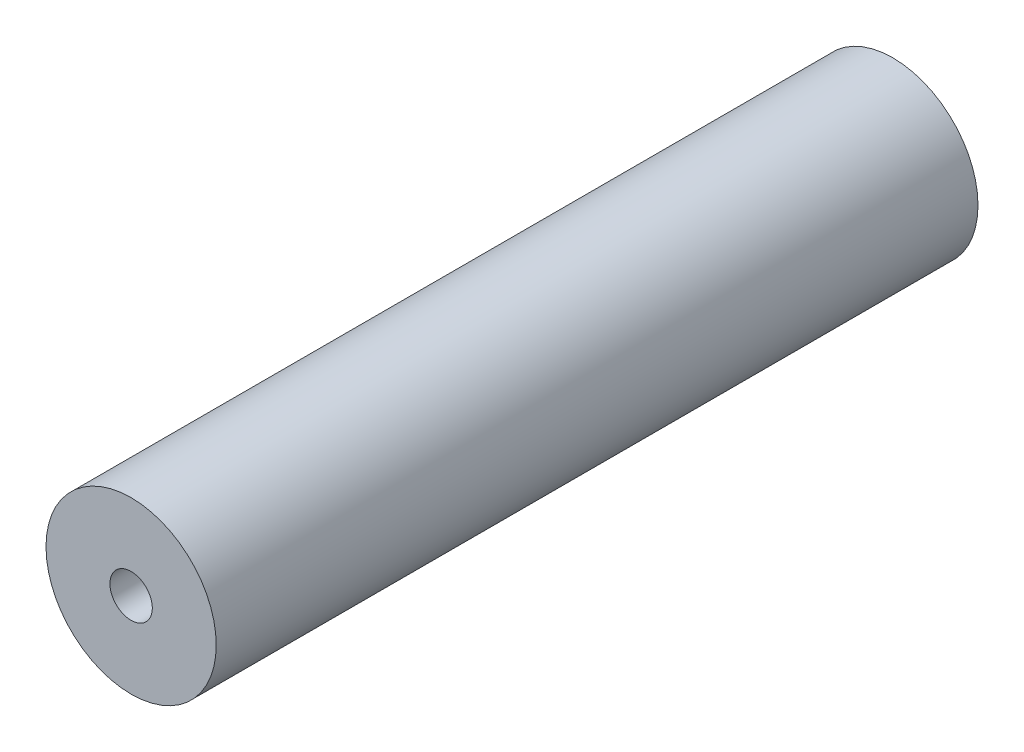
SolidWorks part; units mm, degrees
ref_plane "Front Plane" through (0, 0, 0) normal (0, 0, 1) x (1, 0, 0)
ref_plane "Top Plane" through (0, 0, 0) normal (0, 1, 0) x (1, 0, 0)
ref_plane "Right Plane" through (0, 0, 0) normal (1, 0, 0) x (0, 0, -1)
sketch "Sketch1" plane through (0, 0, 0) normal (0, 0, 1) x (1, 0, 0)
  circle A0 centre (229.2265, -84.2) radius 2.4892 construction
  circle A1 centre (229.2265, -84.2) radius 10 construction
  circle A2 centre (229.2265, -84.2) radius 2.4892
  circle A3 centre (229.2265, -84.2) radius 10
extrude "Boss-Extrude1" add sketch "Sketch1" along normal blind 89.5 contours A3 A2
